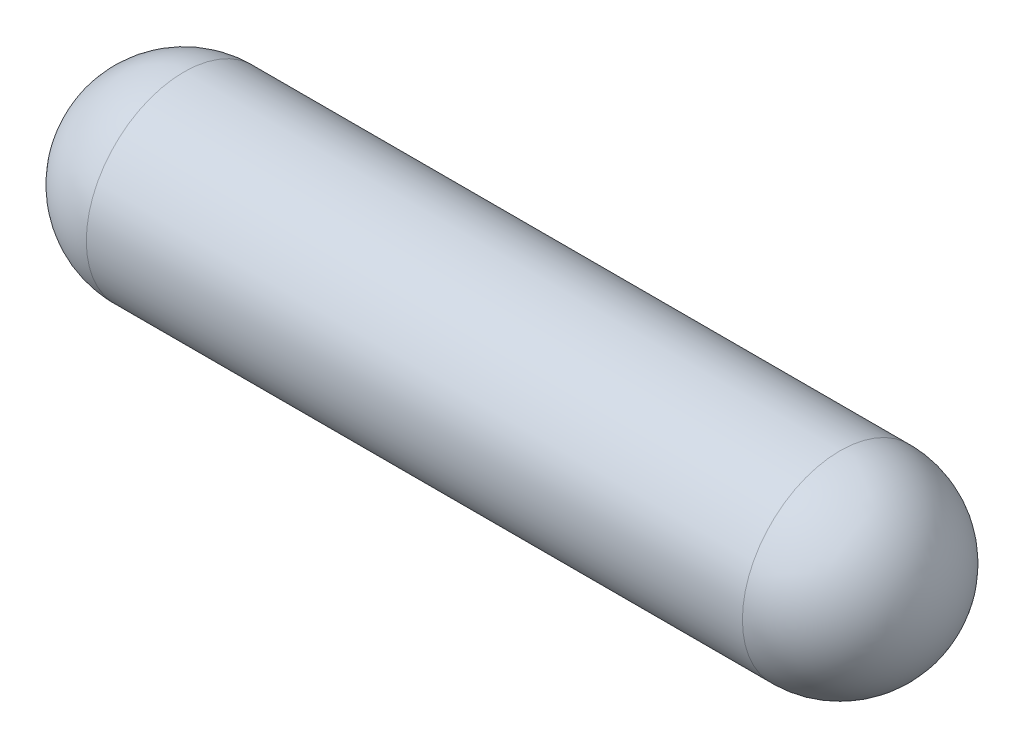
SolidWorks part; units mm, degrees
ref_plane "Plane1" through (0, 0, 0) normal (0, 0, 1) x (1, 0, 0)
ref_plane "Plane2" through (0, 0, 0) normal (0, 1, 0) x (1, 0, 0)
ref_plane "Plane3" through (0, 0, 0) normal (1, 0, 0) x (0, 0, -1)
sketch "Sketch1" plane through (0, 0, 0) normal (0, 0, 1) x (1, 0, 0)
  line L1 (-20.828, 2.3876) -> (0, 2.3876)
  line L2 (0, 2.3876) -> (-21.9851, 2.3876) construction
  line L3 (0, 2.3876) -> (1.0259, 2.3876) construction
  line L4 (-18.4404, 4.7752) -> (-2.3876, 4.7752)
  arc A0 (-18.4404, 4.7752) -> (-20.828, 2.3876) centre (-18.4404, 2.3876) ccw
  arc A1 (0, 2.3876) -> (-2.3876, 4.7752) centre (-2.3876, 2.3876) ccw
  dimension "D1" = 4.7752
  dimension "D2" = 4.7752
revolve "Base-Revolve" add sketch "Sketch1" angle 360 about L3
